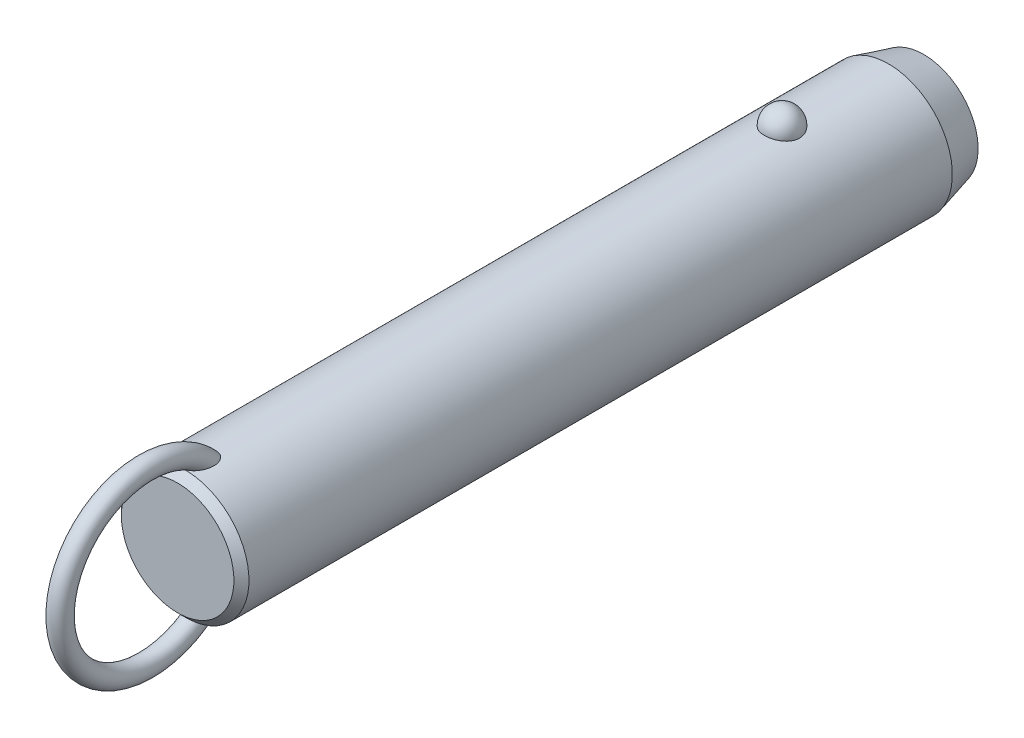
SolidWorks part; units mm, degrees
ref_plane "Front Plane" through (0, 0, 0) normal (0, 0, 1) x (1, 0, 0)
ref_plane "Top Plane" through (0, 0, 0) normal (0, 1, 0) x (1, 0, 0)
ref_plane "Right Plane" through (0, 0, 0) normal (1, 0, 0) x (0, 0, -1)
sketch "Sketch2" plane through (0, 0, 0) normal (0, 0, 1) x (1, 0, 0)
  circle A0 centre (0, 0) radius 12.7
  point P3 (0, 12.7)
  dimension "D1" = 25.4
extrude "Boss-Extrude1" add sketch "Sketch2" along normal blind 104.1
sketch "Sketch3" plane through (0, 0, 0) normal (0, 0, -1) x (-1, 0, 0)
  circle A0 centre (0, 0) radius 12.7
  dimension "D1" = 25.4
extrude "Boss-Extrude2" add sketch "Sketch3" along normal blind 31.7
chamfer "Chamfer1" distance 7 angle 15 1 edges at (-12.7, 0, -31.7)
sketch "Sketch12" plane through (0, 0, 0) normal (1, 0, 0) x (0, 0, -1)
  line L0 (-104.1, 12.7) -> (-104.1, -12.7) construction
  point P0 (-104.1, 0)
sketch "Sketch13" plane through (0, 0, 0) normal (1, 0, 0) x (0, 0, -1)
  circle A0 centre (-123.15, 0) radius 19.05
  point P2 (-104.1, 0)
  dimension "D1" = 38.1
sketch "Sketch14" plane through (0, 0, 0) normal (0, 1, 0) x (1, 0, 0)
  circle A0 centre (0, -106.1) radius 2
  point P2 (0, -104.1)
  dimension "D1" = 4
sweep "Sweep1" add profiles "Sketch14" path "Sketch13"
sketch "Sketch15" plane through (0, 0, 104.1) normal (0, 0, 1) x (1, 0, 0)
  circle A0 centre (0, 0) radius 12.7
  dimension "D1" = 25.4
extrude "Boss-Extrude3" add sketch "Sketch15" along normal blind 12.7
chamfer "Chamfer2" distance 1.5 angle 45 1 edges at (12.7, 0, 116.8)
sketch "Sketch18" plane through (0, 0, 0) normal (1, 0, 0) x (0, 0, -1)
  line L0 (24.7, 12.7) -> (-108.951, 12.7) construction
  line L1 (3.5, 16.2) -> (3.5, 9.2)
  line L2 (-108.951, -12.7) -> (24.7, -12.7) construction
  arc A0 (3.5, 16.2) -> (3.5, 9.2) centre (3.5, 12.7) ccw
  point P4 (0, 12.7)
  dimension "D1" = 28.9
revolve "Revolve1" add sketch "Sketch18" angle 360 about L1
